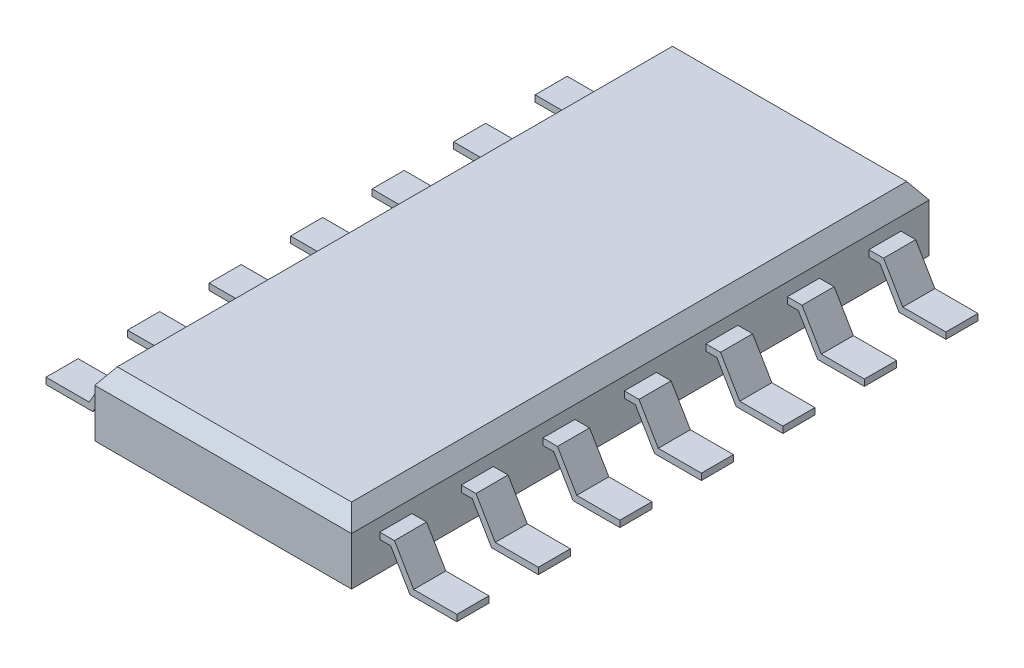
SolidWorks part; units mm, degrees
ref_plane "Front Plane" through (0, 0, 0) normal (0, 0, 1) x (1, 0, 0)
ref_plane "Top Plane" through (0, 0, 0) normal (0, 1, 0) x (1, 0, 0)
ref_plane "Right Plane" through (0, 0, 0) normal (1, 0, 0) x (0, 0, -1)
sketch "Sketch1" plane through (0, 0, 0) normal (0, 1, 0) x (1, 0, 0)
  line L0 (0, 6.8835) -> (0, -6.8835) construction
  line L1 (-5.5575, 0) -> (5.5575, 0) construction
  line L3 (-2, 4.4998) -> (2, 4.4998)
  line L4 (-2, 4.4998) -> (-2, -4.4998)
  line L5 (-2, -4.4998) -> (2, -4.4998)
  line L6 (2, 4.4998) -> (2, -4.4998)
  dimension "D1" = 4
  dimension "D2" = 8.9997
extrude "Extrude1" add sketch "Sketch1" along normal mid plane 1
chamfer "Chamfer1" distance 0.25 angle 35 4 edges at (0, 0.5, -4.4998) (2, 0.5, 0) (0, 0.5, 4.4998) (-2, 0.5, 0)
sketch "Sketch4" plane through (0, 0, 0) normal (0, 0, 1) x (1, 0, 0)
  line L0 (0, 1.2724) -> (0, -0.9364) construction
  line L1 (-2, 1.8525) -> (-2, -1.3157) construction
  line L2 (-2, 0.25) -> (-2, -0.5) construction
  line L3 (0, 0) -> (-6.2695, 0) construction
  line L4 (-3.2, 1.2724) -> (-3.2, -1.1019) construction
  line L5 (-2, 0) -> (-2.2, 0)
  line L6 (-2.2, 0) -> (-2.5, -0.51)
  line L7 (-2.5, -0.51) -> (-3.2, -0.51)
  line L9 (-2, -0.5) -> (2, -0.5) construction
  point P19 (-2.2, 0)
  point P22 (-2.5, -0.51)
  dimension "D1" = 1.2
  dimension "D2" = 0.01
  dimension "D3" = 0.7
  dimension "D4" = 0.2
extrude "Extrude-Thin1" add sketch "Sketch4" along normal mid plane 0.5 thin
pattern_linear "LPattern1" count 4 spacing 1.27 along (0, 0, -1) count 4 spacing 1.27 along (0, 0, 1) of "Extrude-Thin1"
mirror "Mirror1" about plane through (0, 0, 0) normal (1, 0, 0) of "LPattern1", "Extrude-Thin1"
